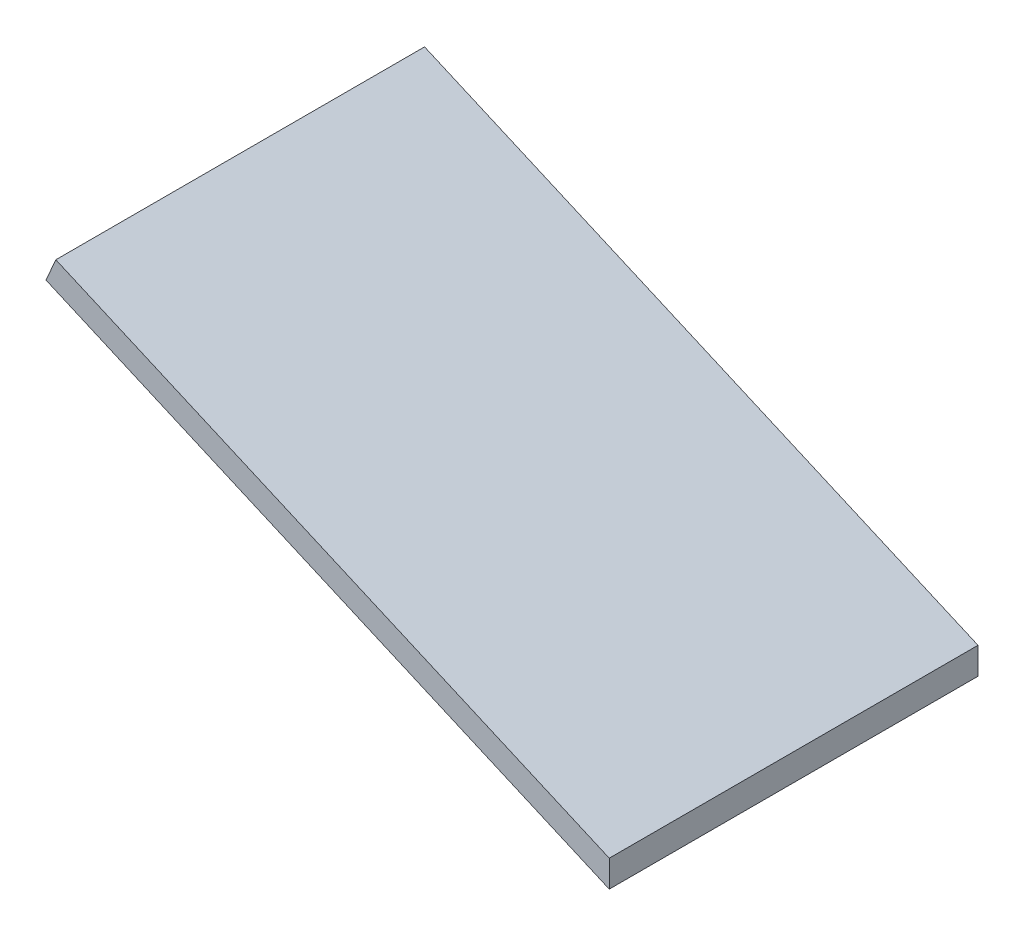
SolidWorks part; units mm, degrees
ref_plane "Plano frontal" through (0, 0, 0) normal (0, 0, 1) x (1, 0, 0)
ref_plane "Plano superior" through (0, 0, 0) normal (0, 1, 0) x (1, 0, 0)
ref_plane "Plano direito" through (0, 0, 0) normal (1, 0, 0) x (0, 0, -1)
sketch "Esboço2" plane through (0, 0, 0) normal (0, 0, 1) x (1, 0, 0)
  line L0 (22.9129, -10) -> (-22.9129, 10)
  line L1 (22.9129, -7.8178) -> (-22.1129, 11.833)
  line L2 (22.9129, -10) -> (22.9129, -7.8178)
  line L3 (-22.9129, 10) -> (-22.1129, 11.833)
  line L5 (23.7129, -8.167) -> (-22.1129, 11.833) construction
  point P4 (0, 0)
  dimension "D1" = 2
extrude "Ressalto-extrusão1" add sketch "Esboço2" along normal blind 30
